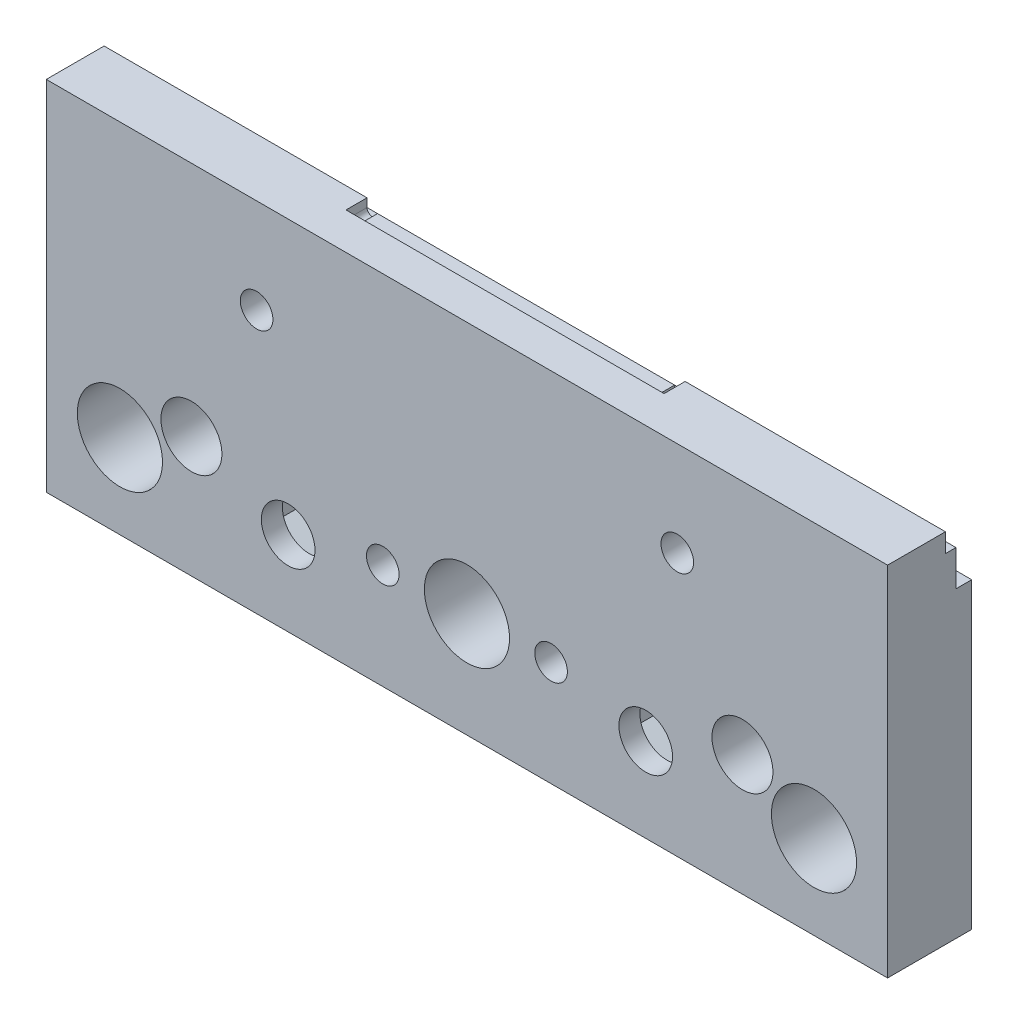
SolidWorks part; units mm, degrees
ref_plane "前视基准面" through (0, 0, 0) normal (0, 0, 1) x (1, 0, 0)
ref_plane "上视基准面" through (0, 0, 0) normal (0, 1, 0) x (1, 0, 0)
ref_plane "右视基准面" through (0, 0, 0) normal (1, 0, 0) x (0, 0, -1)
sketch "前视图草图" plane through (0, 0, 0) normal (0, 0, 1) x (1, 0, 0)
  line L0 (0, 0) -> (44.4821, 0) construction
  line L1 (0, 0) -> (0, 28.3185) construction
sketch "草图2" plane through (0, 0, 0) normal (0, 0, 1) x (1, 0, 0)
  line L0 (0, 0) -> (80, 0)
  line L1 (-200000, 0) -> (200044.4821, 0) construction
  line L2 (80, 0) -> (80, 34)
  line L3 (80, 34) -> (0, 34)
  line L4 (0, -200000) -> (0, 200028.3185) construction
  line L5 (0, 34) -> (0, 0)
  circle A0 centre (7, 8) radius 4.05
  circle A1 centre (40, 10) radius 4.05
  circle A2 centre (73, 8) radius 4.05
  dimension "D3" = 8
  dimension "D5" = 10
  dimension "D9" = 8.1
  dimension "D10" = 8.1
  dimension "D11" = 8.1
  dimension "D1" = 34
  dimension "D2" = 80
  dimension "D4" = 7
  dimension "D6" = 7
  dimension "D7" = 8
  dimension "D8" = 40
extrude "凸台-拉伸1" add sketch "草图2" along normal blind 8
sketch "草图3" plane through (0, 0, 8) normal (0, 0, 1) x (1, 0, 0)
  line L0 (16.088, 8) -> (31.4805, 8) construction
  line L1 (7, 8) -> (7, 16.8386) construction
  line L2 (73, 8) -> (73, 16.5917) construction
  line L4 (-200000, 0) -> (200044.4821, 0) construction
  circle A2 centre (23, 8) radius 2.55
  circle A3 centre (57, 8) radius 2.55
  dimension "D4" = 5.1
  dimension "D5" = 5.1
  dimension "D1" = 8
  dimension "D2" = 16
  dimension "D3" = 16
extrude "切除-拉伸1" cut sketch "草图3" against normal through all
sketch "草图4" plane through (80, 0, 0) normal (1, 0, 0) x (0, 0, -1)
  line L1 (0, -200000) -> (0, 200028.3185) construction
  line L2 (-1.5, 32.2) -> (-2.5, 32.2)
  line L3 (-2.5, 32.2) -> (-2.5, 34)
  line L4 (-8, 34) -> (0, 34) construction
  line L5 (-2.5, 34) -> (0, 34)
  line L6 (-1.5, 32.2) -> (-1.5, 28.8)
  line L7 (-1.5, 28.8) -> (0, 28.8)
  line L8 (0, 28.8) -> (0, 34)
  dimension "D1" = 3.4
  dimension "D2" = 2.5
  dimension "D3" = 1.5
  dimension "D4" = 1.8
extrude "切除-拉伸2" cut sketch "草图4" against normal through all
sketch "草图5" plane through (0, 0, 8) normal (0, 0, 1) x (1, 0, 0)
  line L0 (40, 10) -> (56.5376, 10) construction
  circle A0 centre (40, 10) radius 8 construction
  circle A1 centre (48, 10) radius 1.55
  circle A2 centre (32, 10) radius 1.55
  dimension "D1" = 3.1
  dimension "D2" = 3.1
  dimension "D3" = 16
extrude "切除-拉伸3" cut sketch "草图5" against normal through all
sketch "草图7" plane through (0, 0, 0) normal (0, 0, -1) x (-1, 0, 0)
  line L0 (-40, 12) -> (-40, -8.3696) construction
  line L1 (-23, 10) -> (-23, -2.3368) construction
  line L2 (200000, 0) -> (-200044.4821, 0) construction
  line L6 (-27.05, 10) -> (-27.05, 2.5)
  line L7 (-29.55, 0) -> (-16.45, 0)
  line L8 (-18.95, 2.5) -> (-18.95, 10)
  line L9 (-23, 8) -> (-23, 15.9045) construction
  line L13 (0, -200000) -> (0, 200028.3185) construction
  line L14 (-57, 8) -> (-57, 15.9045) construction
  line L15 (-57, 10) -> (-57, -2.3368) construction
  line L16 (-61.05, 2.5) -> (-61.05, 10)
  line L17 (-50.45, 0) -> (-63.55, 0)
  line L18 (-52.95, 10) -> (-52.95, 2.5)
  arc A1 (-18.95, 10) -> (-27.05, 10) centre (-23, 10) ccw
  arc A4 (-29.55, 0) -> (-27.05, 2.5) centre (-29.55, 2.5) ccw
  arc A5 (-18.95, 2.5) -> (-16.45, 0) centre (-16.45, 2.5) ccw
  arc A7 (-61.05, 2.5) -> (-63.55, 0) centre (-63.55, 2.5) cw
  arc A8 (-50.45, 0) -> (-52.95, 2.5) centre (-50.45, 2.5) cw
  arc A9 (-61.05, 10) -> (-52.95, 10) centre (-57, 10) cw
  dimension "D1" = 40
  dimension "D4" = 8.1
  dimension "D7" = 2.5
  dimension "D8" = 2.5
  dimension "D3" = 10
extrude "切除-拉伸4" [suppressed] cut sketch "草图7" against normal blind 6
sketch "草图8" plane through (0, 0, 0) normal (0, 0, -1) x (-1, 0, 0)
  line L0 (-40, 10) -> (-57.3165, 10) construction
  line L1 (-40, 20) -> (-40, 35.6562) construction
  line L2 (-30.5, 12.85) -> (-49.5, 12.85)
  line L3 (-49.5, 7.15) -> (-30.5, 7.15)
  line L4 (200000, 0) -> (-200044.4821, 0) construction
  line L5 (-80, 0) -> (-80, 28.8) construction
  line L6 (-48, 6.7091) -> (-45.15, 8.3546)
  line L7 (-45.15, 8.3546) -> (-45.15, 11.6454)
  line L8 (-45.15, 11.6454) -> (-48, 13.2909)
  line L9 (-48, 13.2909) -> (-50.85, 11.6454)
  line L10 (-50.85, 11.6454) -> (-50.85, 8.3546)
  line L11 (-50.85, 8.3546) -> (-48, 6.7091)
  line L12 (-34.85, 11.6454) -> (-34.85, 8.3546)
  line L13 (-34.85, 8.3546) -> (-32, 6.7091)
  line L14 (-32, 6.7091) -> (-29.15, 8.3546)
  line L15 (-29.15, 8.3546) -> (-29.15, 11.6454)
  line L16 (-29.15, 11.6454) -> (-32, 13.2909)
  line L17 (-32, 13.2909) -> (-34.85, 11.6454)
  arc A0 (-30.5, 7.15) -> (-30.5, 12.85) centre (-30.5, 10) ccw
  arc A1 (-49.5, 12.85) -> (-49.5, 7.15) centre (-49.5, 10) ccw
  circle A2 centre (-48, 10) radius 2.85 construction
  circle A3 centre (-32, 10) radius 2.85 construction
  dimension "D1" = 5.7
  dimension "D2" = 9.5
  dimension "D3" = 9.5
  dimension "D4" = 10
  dimension "D5" = 5.7
sketch "草图11" plane through (0, 0, 0) normal (0, 0, -1) x (-1, 0, 0)
  line L0 (0, 34) -> (-80, 34) construction
  line L1 (-80, 0) -> (-80, 28.8) construction
  line L2 (0, -200000) -> (0, 200028.3185) construction
  line L3 (-40, 20) -> (-40, 13.5744) construction
  line L4 (-28.772, 25) -> (-45.9396, 25) construction
  circle A0 centre (-60, 25) radius 1.55
  circle A1 centre (-20, 25) radius 1.55
  point P23 (-40, 20)
  dimension "D1" = 3.1
  dimension "D2" = 3.1
  dimension "D3" = 20
  dimension "D4" = 20
  dimension "D5" = 9
sketch "草图20" plane through (0, 0, 0) normal (0, 0, -1) x (-1, 0, 0)
  circle A0 centre (-40, 10) radius 5.5
  dimension "D1" = 11
extrude "切除-拉伸15" cut sketch "草图8" against normal blind 4.5 contours L10 L11 L6 L7 L8 L9 | L13 L14 L15 L16 L17 L12
extrude "切除-拉伸7" cut sketch "草图11" against normal through all contours A0 | A1
sketch "草图12" plane through (0, 0, 0) normal (0, 0, -1) x (-1, 0, 0)
  line L0 (-62.5, 22.15) -> (-57.5, 22.15)
  line L1 (-57.5, 27.85) -> (-62.5, 27.85)
  line L4 (-80, 0) -> (-80, 28.8) construction
  line L5 (-39.1423, 25) -> (-43.2672, 25) construction
  line L6 (-60, 21) -> (-60, 25.2385) construction
  line L7 (-20, 21) -> (-20, 26.1603) construction
  line L8 (-40, 20) -> (-40, 24.3689) construction
  line L9 (-17.5, 27.85) -> (-22.5, 27.85)
  line L10 (-22.5, 22.15) -> (-17.5, 22.15)
  line L11 (0, -200000) -> (0, 200028.3185) construction
  line L12 (0, 34) -> (-80, 34) construction
  arc A0 (-62.5, 27.85) -> (-62.5, 22.15) centre (-62.5, 25) ccw
  arc A1 (-57.5, 22.15) -> (-57.5, 27.85) centre (-57.5, 25) ccw
  arc A4 (-17.5, 22.15) -> (-17.5, 27.85) centre (-17.5, 25) ccw
  arc A5 (-22.5, 27.85) -> (-22.5, 22.15) centre (-22.5, 25) ccw
  point P16 (-38, 21)
  point P28 (-40, 25)
  dimension "D2" = 20
  dimension "D3" = 5
  dimension "D4" = 2.5
  dimension "D5" = 20
  dimension "D6" = 9
  dimension "D1" = 2
sketch "草图19" plane through (0, 0, 2.5) normal (0, 0, -1) x (-1, 0, 0)
  line L0 (0, 34) -> (-80, 34) construction
  line L1 (-25, 34) -> (-55.2479, 34)
  line L2 (-25, 34) -> (-25, 33.2)
  line L3 (-26, 33.2) -> (-54.2479, 33.2)
  line L4 (-55.2479, 34) -> (-55.2479, 33.2)
  line L5 (0, -200000) -> (0, 200028.3185) construction
  line L7 (0, 32.2) -> (-80, 32.2) construction
  line L8 (-56.3335, 32.7) -> (-52.9089, 32.7) construction
  line L9 (-55.2479, 1028.5823) -> (-55.2479, 33.2) construction
  line L10 (-25, 1028.5823) -> (-25, 32.7) construction
  line L11 (-55.2479, 32.7) -> (-55.2479, -973.3) construction
  line L12 (-25, 32.7) -> (-25, -973.3) construction
  arc A3 (-55.2479, 33.2) -> (-54.2479, 33.2) centre (-54.7479, 33.2) ccw
  arc A6 (-26, 33.2) -> (-25, 33.2) centre (-25.5, 33.2) ccw
  dimension "D3" = 1
  dimension "D4" = 1
  dimension "D2" = 0.8
  dimension "D1" = 0.5
  dimension "D9" = 25
extrude "切除-拉伸11" cut sketch "草图19" against normal blind 2
sketch "草图21" plane through (0, 0, 0) normal (0, 0, -1) x (-1, 0, 0)
  line L0 (-80, 11.5) -> (0, 11.5) construction
  line L1 (-80, 0) -> (-80, 28.8) construction
  line L2 (0, -200000) -> (0, 200028.3185) construction
  line L3 (-66.2, 28.8) -> (-66.2, 0) construction
  line L4 (0, 28.8) -> (-80, 28.8) construction
  line L5 (200000, 0) -> (-200044.4821, 0) construction
  line L6 (-40, 28.8) -> (-40, 0) construction
  line L7 (-40, -199980) -> (-40, 200024.3689) construction
  circle A0 centre (-66.2, 11.5) radius 2.9
  circle A1 centre (-13.8, 11.5) radius 2.9
  dimension "D3" = 5.8
  dimension "D1" = 11.5
  dimension "D2" = 13.8
extrude "切除-拉伸13" cut sketch "草图21" against normal through all
sketch "草图22" plane through (0, 0, 0) normal (0, 0, -1) x (-1, 0, 0)
  line L0 (-80, 0) -> (-80, 28.8) construction
  line L1 (-52.9, 5.6329) -> (-52.9, 10.3671)
  line L2 (-52.9, 10.3671) -> (-57, 12.7343)
  line L3 (-57, 12.7343) -> (-61.1, 10.3671)
  line L4 (-61.1, 10.3671) -> (-61.1, 5.6329)
  line L5 (-61.1, 5.6329) -> (-57, 3.2657)
  line L6 (-57, 3.2657) -> (-52.9, 5.6329)
  line L7 (-23, 3.2657) -> (-18.9, 5.6329)
  line L8 (-18.9, 5.6329) -> (-18.9, 10.3671)
  line L9 (-18.9, 10.3671) -> (-23, 12.7343)
  line L10 (-23, 12.7343) -> (-27.1, 10.3671)
  line L11 (-27.1, 10.3671) -> (-27.1, 5.6329)
  line L12 (-27.1, 5.6329) -> (-23, 3.2657)
  circle A0 centre (-57, 8) radius 4.1 construction
  circle A1 centre (-23, 8) radius 4.1 construction
  dimension "D1" = 8.2
extrude "切除-拉伸14" cut sketch "草图22" against normal blind 6
